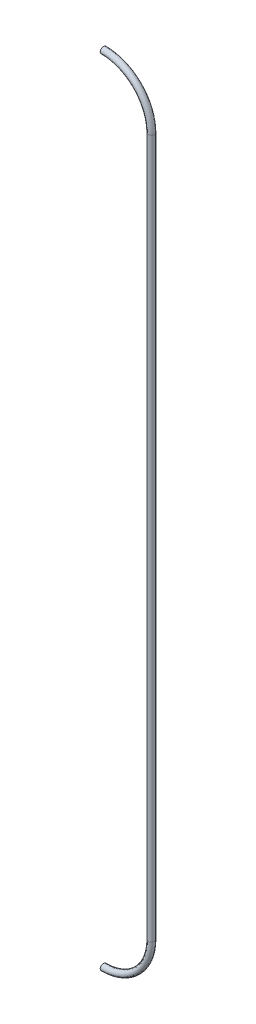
SolidWorks part; units mm, degrees
ref_plane "Plan de face" through (0, 0, 0) normal (0, 0, 1) x (1, 0, 0)
ref_plane "Plan de dessus" through (0, 0, 0) normal (0, 1, 0) x (1, 0, 0)
ref_plane "Plan de droite" through (0, 0, 0) normal (1, 0, 0) x (0, 0, -1)
sketch "Esquisse1" plane through (0, 0, 0) normal (0, 1, 0) x (1, 0, 0)
  line L0 (0, 0) -> (68.1408, -68.1408) construction
  line L1 (0, 0) -> (0, -68.5206) construction
  circle A0 centre (0, 0) radius 36
  circle A1 centre (0, 0) radius 31
  dimension "D1" = 72
  dimension "D3" = 45
  dimension "D2" = 5
ref_plane "Plan1" through (35, 0, 0) normal (1, 0, 0) x (0, 0, -1)
sketch "Esquisse2" plane through (35, 0, 0) normal (1, 0, 0) x (0, 0, -1)
  line L0 (0, 0) -> (0, 25) construction
  circle A0 centre (0, 19) radius 6
  dimension "D1" = 12
  dimension "D2" = 19
sketch "Esquisse3" plane through (0, 0, 0) normal (0, 0, 1) x (1, 0, 0)
  line L1 (35, 13) -> (35, 25) construction
  line L2 (36, 0) -> (36, -70.9944) construction
  line L3 (36, -70.9944) -> (126, -70.9944) construction
  line L4 (126, -70.9944) -> (126, -1390.9944)
  line L5 (-61.8873, -730.9944) -> (342.0749, -730.9944) construction
  arc A0 (35, 19) -> (126, -70.9944) centre (36, -70.9944) cw
  arc A1 (35, -1480.9889) -> (126, -1390.9944) centre (36, -1390.9944) ccw
  dimension "D1" = 90
  dimension "D2" = 1320
  dimension "D3" = 36
sweep "Balayage1" add profiles "Esquisse2" path "Esquisse3"
sketch "Esquisse4" plane through (0, 0, 0) normal (0, 1, 0) x (1, 0, 0)
  circle A0 centre (0, 0) radius 36
  dimension "D1" = 72
extrude "Enlèv. mat.-Extru.1" cut sketch "Esquisse4" against normal through all and the other way through all
